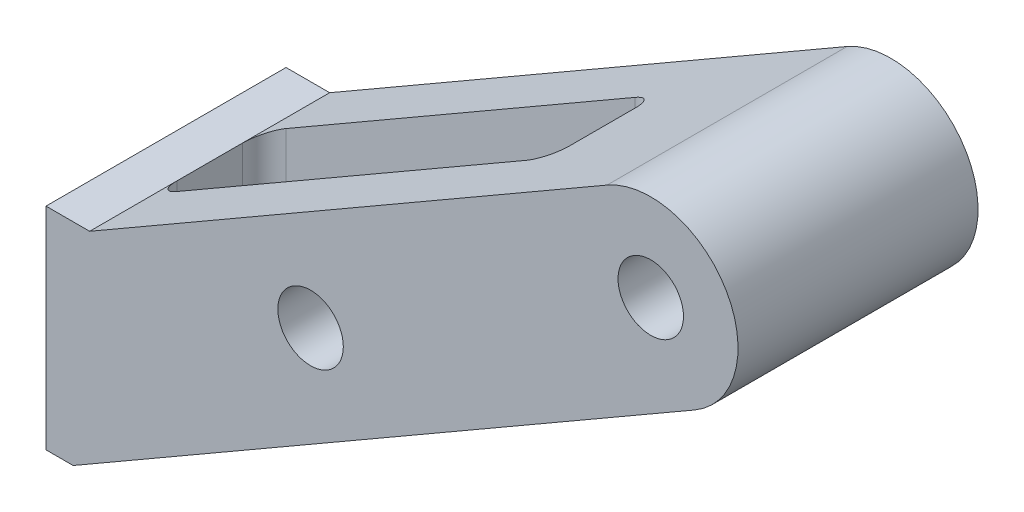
SolidWorks part; units mm, degrees
ref_plane "Plan1" through (0, 0, 0) normal (0, 0, 1) x (1, 0, 0)
ref_plane "Plan2" through (0, 0, 0) normal (0, 1, 0) x (1, 0, 0)
ref_plane "Plan3" through (0, 0, 0) normal (1, 0, 0) x (0, 0, -1)
sketch "Esquisse1" plane through (0, 0, 0) normal (0, 0, 1) x (1, 0, 0)
  line L0 (0, 0) -> (55.4256, 32) construction
  line L1 (0, 0) -> (54, 0) construction
  line L2 (4, 11.547) -> (51.4256, 38.9282)
  line L3 (0, 11.547) -> (4, 11.547)
  line L4 (59.4256, 25.0718) -> (0, -9.2376)
  line L5 (0, -9.2376) -> (0, 11.547)
  arc A0 (59.4256, 25.0718) -> (51.4256, 38.9282) centre (55.4256, 32) ccw
  dimension "D1" = 30
  dimension "D2" = 16
  dimension "D3" = 64
  dimension "D4" = 4
extrude "BASE" add sketch "Esquisse1" along normal mid plane 22
hole_wizard "passage axe" positions "Esquisse4" profile "Esquisse3"
sketch "Esquisse4" plane through (0, 0, 11) normal (0, 0, 1) x (1, 0, 0)
  line L0 (0, 0) -> (55.4256, 32) construction
  arc A0 (59.4256, 25.0718) -> (51.4256, 38.9282) centre (55.4256, 32) ccw construction
  point P0 (55.4256, 32)
  point P1 (24.2487, 14)
  dimension "D2" = 36
sketch "Esquisse3" plane through (55.4256, 32, 11) normal (1, 0, 0) x (0, -1, 0)
  line L0 (0, 0) -> (0, 22)
  line L1 (0, 22) -> (3, 22)
  line L2 (3, 22) -> (3, 0)
  line L5 (3, 0) -> (0, 0)
  line L11 (0, -6.35) -> (0, 107.95) construction
  dimension "Diamètre du perçage jusqu'au prochain" = 6
  dimension "Profondeur du perçage jusqu'au prochain" = 22
sketch "Esquisse5" plane through (0, 0, 0) normal (0, 1, 0) x (0, 0, 1)
  line L1 (3, 4) -> (-3, 4)
  line L2 (5, 6) -> (5, 38)
  line L3 (3, 40) -> (-3, 40)
  line L4 (-5, 6) -> (-5, 38)
  line L6 (0, 0) -> (0, 53) construction
  line L8 (11, 0) -> (-11, 0) construction
  arc A0 (-3, 4) -> (-5, 6) centre (-3, 6) cw
  arc A1 (3, 4) -> (5, 6) centre (3, 6) ccw
  arc A2 (-3, 40) -> (-5, 38) centre (-3, 38) ccw
  arc A3 (5, 38) -> (3, 40) centre (3, 38) ccw
  dimension "D4" = 2
  dimension "D1" = 10
  dimension "D2" = 4
  dimension "D3" = 40
extrude "POCHE" cut sketch "Esquisse5" against normal through all and the other way through all
sketch "Esquisse6" plane through (0, 0, 0) normal (-1, 0, 0) x (0, 0, 1)
  line L0 (5, 14) -> (11, 14) construction
  line L1 (0, -50) -> (0, 50) construction
  circle A0 centre (0, -18) radius 15
  dimension "D2" = 30
  dimension "D1" = 32
extrude "PASAGE TIGE" cut sketch "Esquisse6" against normal through all
